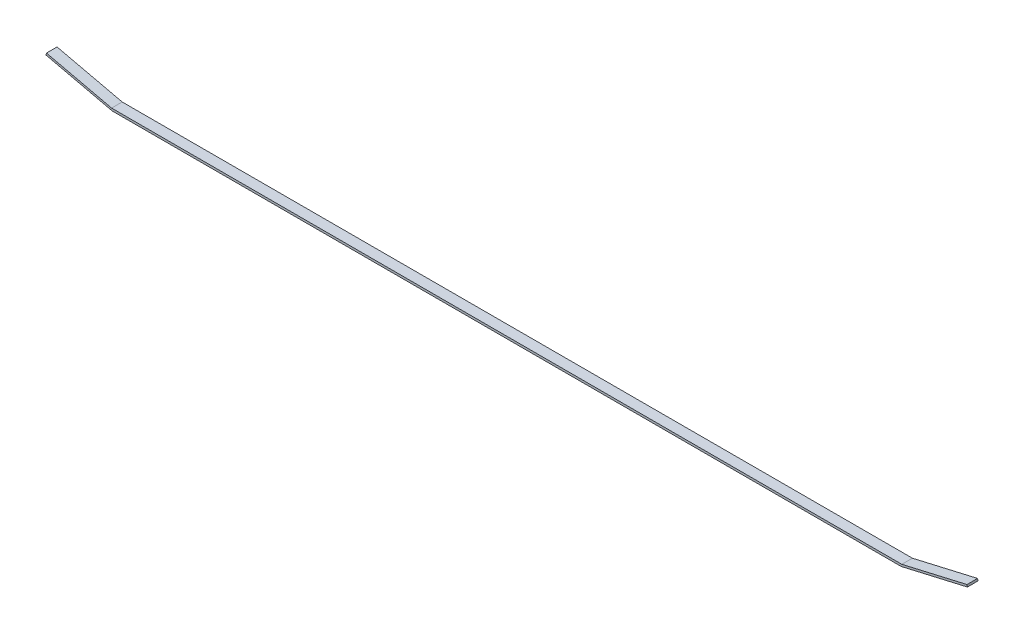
SolidWorks part; units mm, degrees
ref_plane "Front Plane" through (0, 0, 0) normal (0, 0, 1) x (1, 0, 0)
ref_plane "Top Plane" through (0, 0, 0) normal (0, 1, 0) x (1, 0, 0)
ref_plane "Right Plane" through (0, 0, 0) normal (1, 0, 0) x (0, 0, -1)
sketch "Sketch1" plane through (0, 0, 0) normal (0, 0, 1) x (1, 0, 0)
  line L0 (-739, -4.2515) -> (49261, -4.2515) construction
  line L1 (261, -4.2515) -> (-261, -4.2515)
  line L2 (261, -4.2515) -> (261, -5.712)
  line L3 (261, -5.712) -> (-261, -5.712)
  line L4 (0, -1004.2515) -> (0, 48995.7485) construction
  line L5 (-261, -5.712) -> (-304.8, 4.411)
  line L6 (261.3895, -4.2515) -> (304.4993, 5.712)
  line L7 (-304.8, 4.411) -> (-304.4993, 5.712)
  line L8 (261, -4.2515) -> (261.3895, -4.2515)
  line L9 (-261, -4.2515) -> (-261.3895, -4.2515)
  line L10 (-261.3895, -4.2515) -> (-304.4993, 5.712)
  line L11 (304.8, 4.411) -> (304.4993, 5.712)
  line L12 (261, -5.712) -> (304.8, 4.411)
  point P12 (0, -4.2515)
extrude "Boss-Extrude1" add sketch "Sketch1" along normal blind 7 contours L9 L10 L7 L5 L3 L2 L1 | L2 L12 L11 L6 L8
